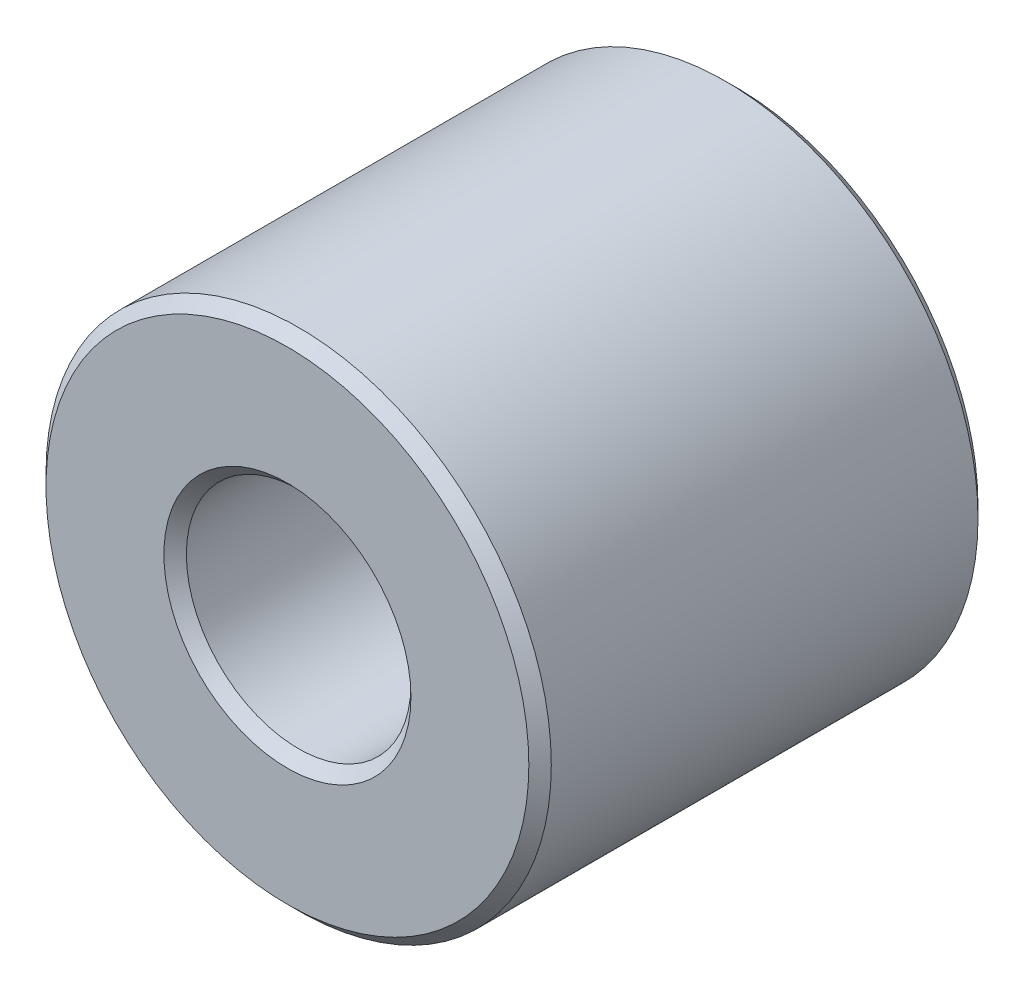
SolidWorks part; units mm, degrees
ref_plane "Front Plane" through (0, 0, 0) normal (0, 0, 1) x (1, 0, 0)
ref_plane "Top Plane" through (0, 0, 0) normal (0, 1, 0) x (1, 0, 0)
ref_plane "Right Plane" through (0, 0, 0) normal (1, 0, 0) x (0, 0, -1)
sketch "Sketch1" plane through (0, 0, 0) normal (0, 0, 1) x (1, 0, 0)
  circle A0 centre (0, 0) radius 10
  circle A1 centre (0, 0) radius 22.5
  dimension "D1" = 20
  dimension "D2" = 45
extrude "Boss-Extrude1" add sketch "Sketch1" along normal mid plane 40
chamfer "Chamfer1" distance 1 angle 45 4 edges at (10, 0, -20) (22.5, 0, -20) (10, 0, 20) (22.5, 0, 20)
